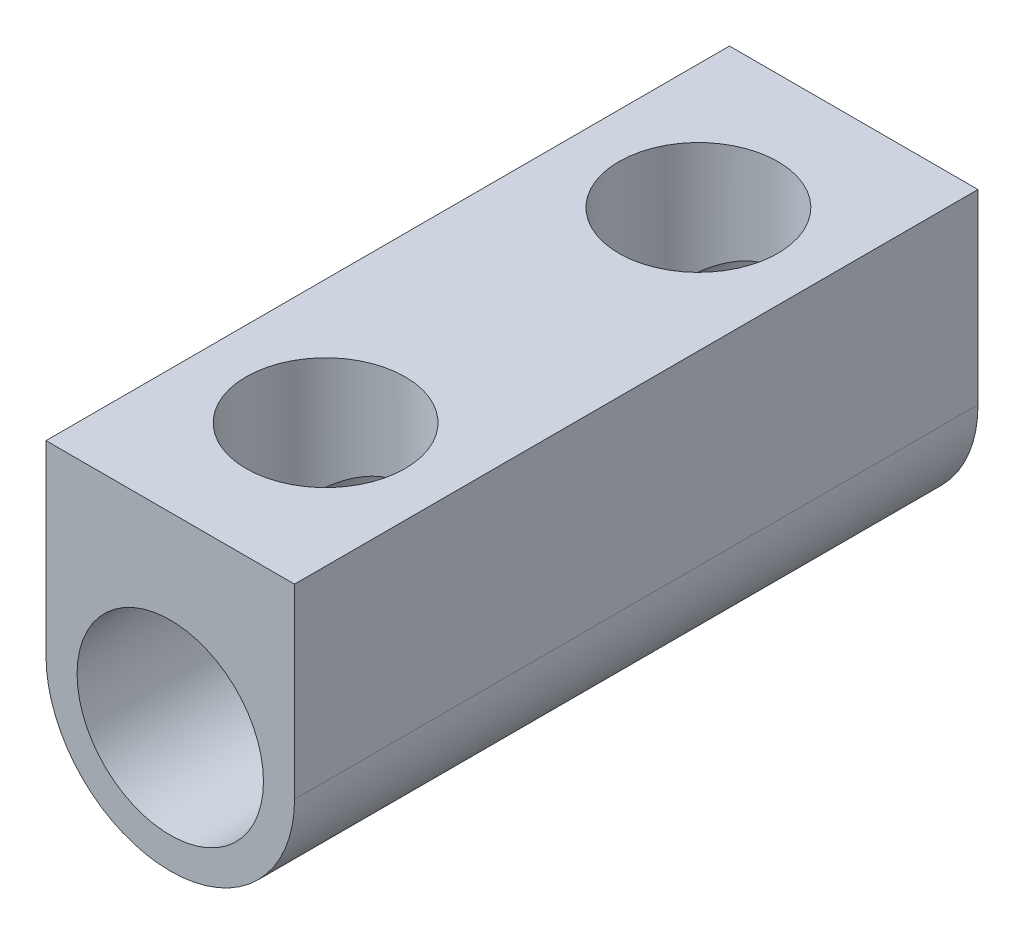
SolidWorks part; units mm, degrees
ref_plane "Plan de face" through (0, 0, 0) normal (0, 0, 1) x (1, 0, 0)
ref_plane "Plan de dessus" through (0, 0, 0) normal (0, 1, 0) x (1, 0, 0)
ref_plane "Plan de droite" through (0, 0, 0) normal (1, 0, 0) x (0, 0, -1)
sketch "Esquisse1" plane through (0, 0, 0) normal (0, 0, 1) x (1, 0, 0)
  line L0 (-6.6587, 5.1429) -> (-6.6587, 0.1429) construction
  line L1 (-8.6587, 5.1429) -> (-4.6587, 5.1429)
  line L2 (-8.6587, 5.1429) -> (-8.6587, 2.1429)
  line L4 (-4.6587, 5.1429) -> (-4.6587, 2.1429)
  arc A0 (-8.6587, 2.1429) -> (-4.6587, 2.1429) centre (-6.6587, 2.1429) ccw
  circle A1 centre (-6.6587, 2.1429) radius 1.5
  dimension "D3" = 2
  dimension "D2" = 3
  dimension "D1" = 4
  dimension "D4" = 3
extrude "Boss.-Extru.1" add sketch "Esquisse1" along normal blind 11
sketch "Esquisse2" plane through (0, 5.1429, 0) normal (0, 1, 0) x (1, 0, 0)
  line L0 (-8.6587, -5.5) -> (-4.6587, -5.5) construction
  line L1 (-8.6587, -11) -> (-8.6587, 0) construction
  line L2 (-4.6587, -11) -> (-4.6587, 0) construction
  line L3 (-6.6587, 0) -> (-6.6587, -11) construction
  line L4 (-4.6587, 0) -> (-8.6587, 0) construction
  line L5 (-4.6587, -11) -> (-8.6587, -11) construction
  circle A0 centre (-6.6587, -2.5) radius 1.28
  circle A1 centre (-6.6587, -19.5) radius 1.28
  circle A2 centre (-6.6587, -8.5) radius 1.28
  dimension "D1" = 3
  dimension "D2" = 2.56
extrude "Enlèv. mat.-Extru.1" cut sketch "Esquisse2" against normal up to surface (2.218 mm away)
